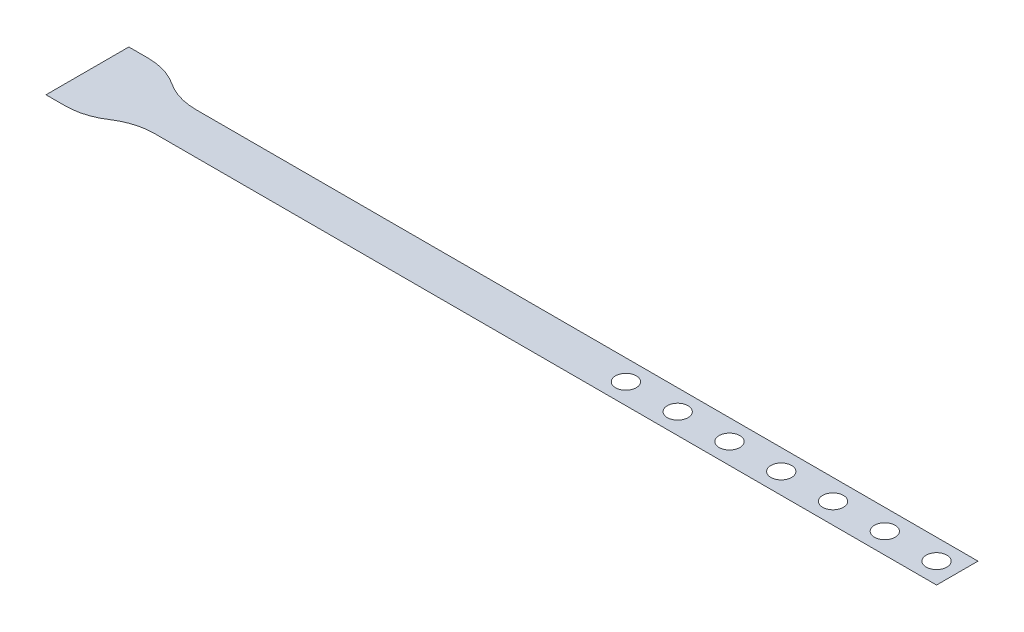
SolidWorks part; units mm, degrees
ref_plane "Front" through (0, 0, 0) normal (0, 0, 1) x (1, 0, 0)
ref_plane "Top" through (0, 0, 0) normal (0, 1, 0) x (1, 0, 0)
ref_plane "Right" through (0, 0, 0) normal (1, 0, 0) x (0, 0, -1)
sketch "Sketch1" plane through (0, 0, 0) normal (1, 0, 0) x (0, 0, -1)
  line L0 (0, 0) -> (23.4419, 0) construction
  line L1 (0, 0) -> (0, 15.8805) construction
  line L3 (-20, -1) -> (20, -1)
  line L4 (-20, -1) -> (-20, 1)
  line L5 (-20, 1) -> (20, 1)
  line L6 (20, -1) -> (20, 1)
  dimension "D1" = 40
  dimension "D2" = 20
  dimension "D3" = 2
  dimension "D4" = 1
extrude "Extrude1" add sketch "Sketch1" against normal blind 800
sketch "Sketch2" plane through (-800, 0, 0) normal (-1, 0, 0) x (0, 0, 1)
  line L1 (-40, -1) -> (40, -1)
  line L2 (-40, -1) -> (-40, 1)
  line L3 (-40, 1) -> (40, 1)
  line L4 (40, -1) -> (40, 1)
  line L6 (-20, 1) -> (20, 1) construction
  line L7 (20, -1) -> (-20, -1) construction
  line L8 (0, 0) -> (0, 18.7577) construction
  dimension "D1" = 80
  dimension "D2" = 40
extrude "Extrude2" add sketch "Sketch2" along normal blind 40
fillet "Fillet1" radius 60 2 edges
fillet "Fillet2" radius 60 2 edges at (-800, 0, -40) (-800, 0, 40)
sketch "Sketch4" plane through (0, 1, 0) normal (0, 1, 0) x (1, 0, 0)
  line L0 (0, 0) -> (-863.8216, 0) construction
  line L1 (0, 20) -> (0, -20) construction
  circle A0 centre (-20, 0) radius 10
  dimension "D1" = 20
  dimension "D2" = 20
extrude "Extrude3" cut sketch "Sketch4" against normal through all
pattern_linear "LPattern1" count 7 spacing 50 along (-1, 0, 0) of "Extrude3"
surface "Surface-Offset3" parameters "D1"=1
delete or keep bodies "Body-Delete2" type delete bodies bodies 110
